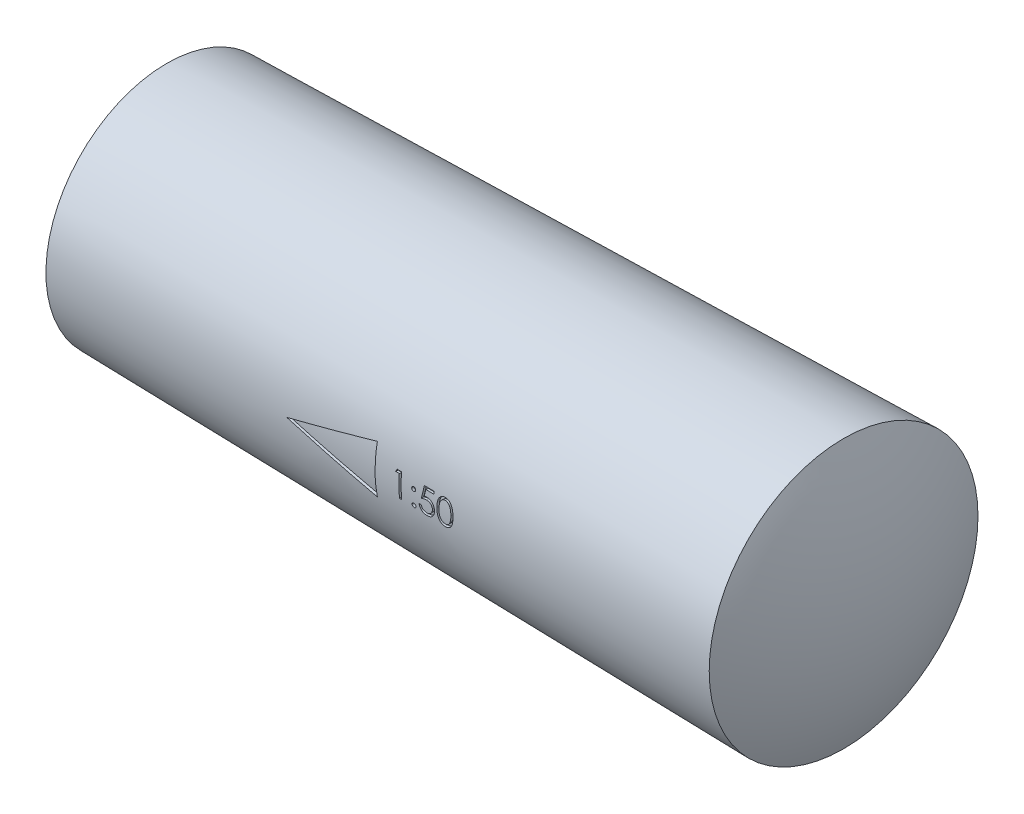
SolidWorks part; units mm, degrees
ref_plane "Front Plane" through (0, 0, 0) normal (0, 0, 1) x (1, 0, 0)
ref_plane "Top Plane" through (0, 0, 0) normal (0, 1, 0) x (1, 0, 0)
ref_plane "Right Plane" through (0, 0, 0) normal (1, 0, 0) x (0, 0, -1)
sketch "Sketch1" plane through (0, 0, 0) normal (1, 0, 0) x (0, 0, -1)
  circle A0 centre (0, 0) radius 5
  dimension "D1" = 10
extrude "Extrude1" add sketch "Sketch1" along normal mid plane 28
draft "Draft1" type of draft neutral plane draft angle 1.146 faces to draft 1 parameters "D1"=1.146
sketch "Sketch2" plane through (0, 0, 0) normal (0, 0, 1) x (1, 0, 0)
  line L0 (-14, 0) -> (-14, 5)
  line L1 (-14, 5) -> (-14, -5) construction
  line L2 (-14, 0) -> (-15.2, 0)
  line L3 (-15.2, 0) -> (-15.2, -5.28) construction
  line L4 (14, 0) -> (14, 5.56)
  line L5 (14, -5.56) -> (14, 5.56) construction
  line L6 (14, 0) -> (15.2, 0)
  line L7 (15.2, 0) -> (15.2, -5.28) construction
  line L8 (-14, -5) -> (14, -5.56) construction
  arc A0 (-15.2, 0) -> (-14, 5) centre (-4.1833, 0) cw
  arc A1 (15.2, 0) -> (14, 5.56) centre (1.7192, 0) ccw
  point P14 (0, -5.28)
revolve "Revolve1" add sketch "Sketch2" angle 360 about L2
sketch "Sketch5" plane through (0, 0, 0) normal (0, 0, 1) x (1, 0, 0)
  line L0 (0, 5.28) -> (0, -5.28) construction
  line L1 (14, 5.56) -> (-14, 5) construction
  line L2 (-14, -5) -> (14, -5.56) construction
ref_plane "Plane2" through (0, 0, 0) normal (-0.02, 0, 0.9998) x (0.9998, 0, 0.02)
sketch "Sketch6" plane through (0, 0, 0) normal (-0.02, 0, 0.9998) x (0.9998, 0, 0.02)
  line L0 (0, 0) -> (0, 1)
  line L1 (0, 5.28) -> (0, -5.28) construction
  line L2 (0, 1) -> (-3.7321, 0)
  line L3 (-3.7321, 0) -> (0, -1)
  line L4 (0, -1) -> (0, 0)
  line L5 (0, -0.5) -> (4, -0.5) construction
  text T0 "1:50" font "Century Gothic" height 1
  dimension "D1" = 2
  dimension "D2" = 30
  dimension "D3" = 4
wrap "Wrap2" sketch "Sketch6" wrap type deboss source sketch "Sketch6" thickness 0.1 parameters "D1"=0.1
equation "\"D2@Sketch2\" = \"D1@Sketch2\""
